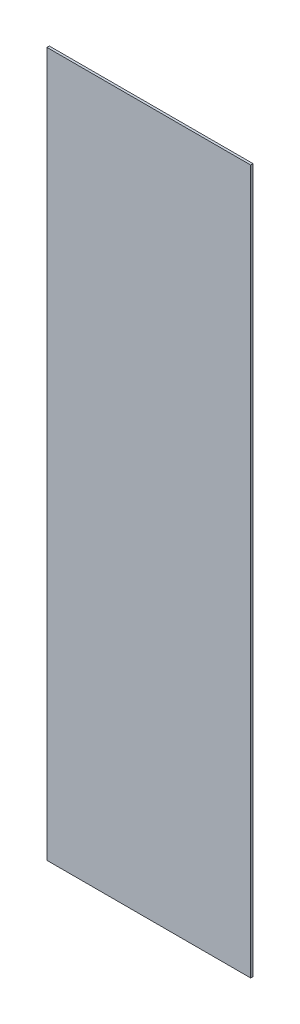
SolidWorks part; units mm, degrees
ref_plane "Alzado" through (0, 0, 0) normal (0, 0, 1) x (1, 0, 0)
ref_plane "Planta" through (0, 0, 0) normal (0, 1, 0) x (1, 0, 0)
ref_plane "Vista lateral" through (0, 0, 0) normal (1, 0, 0) x (0, 0, -1)
sketch "Croquis1" plane through (0, 0, 0) normal (0, 0, 1) x (1, 0, 0)
  line L1 (0, 0) -> (340, 0)
  line L2 (0, 0) -> (0, 1175)
  line L3 (0, 1175) -> (340, 1175)
  line L4 (340, 0) -> (340, 1175)
  dimension "D1" = 340
  dimension "D2" = 1175
extrude "Saliente-Extruir1" add sketch "Croquis1" along normal blind 4
